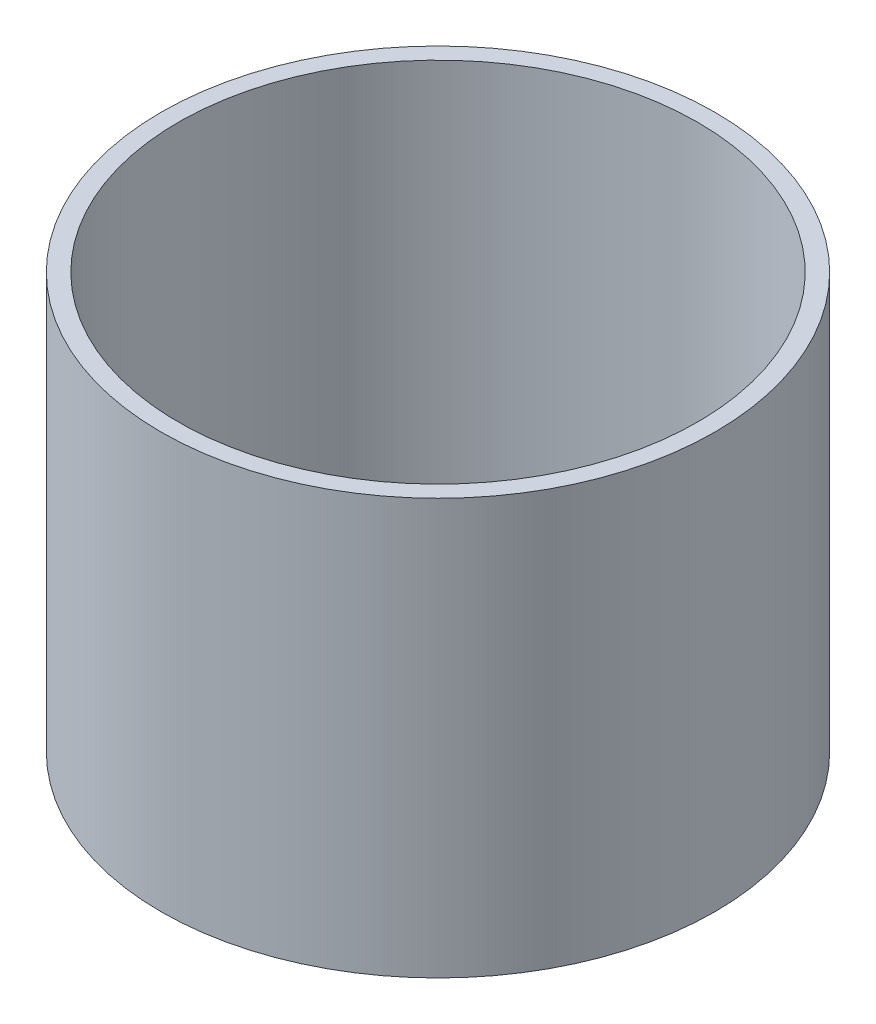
SolidWorks part; units mm, degrees
ref_plane "Face" through (0, 0, 0) normal (0, 0, 1) x (1, 0, 0)
ref_plane "Dessus" through (0, 0, 0) normal (0, 1, 0) x (1, 0, 0)
ref_plane "Droite" through (0, 0, 0) normal (1, 0, 0) x (0, 0, -1)
sketch "Esquisse1" plane through (0, 0, 0) normal (0, 0, 1) x (1, 0, 0)
  line L0 (-37.5, 0) -> (-37.5, 60)
  line L1 (-37.5, 60) -> (-40, 60)
  line L2 (-40, 60) -> (-40, 0)
  line L3 (-40, 0) -> (-37.5, 0)
  line L4 (0, 0) -> (0, 17.7755) construction
  dimension "D1" = 80
  dimension "D2" = 75
  dimension "D3" = 60
revolve "Révolution1" add sketch "Esquisse1" angle 360 about L4
